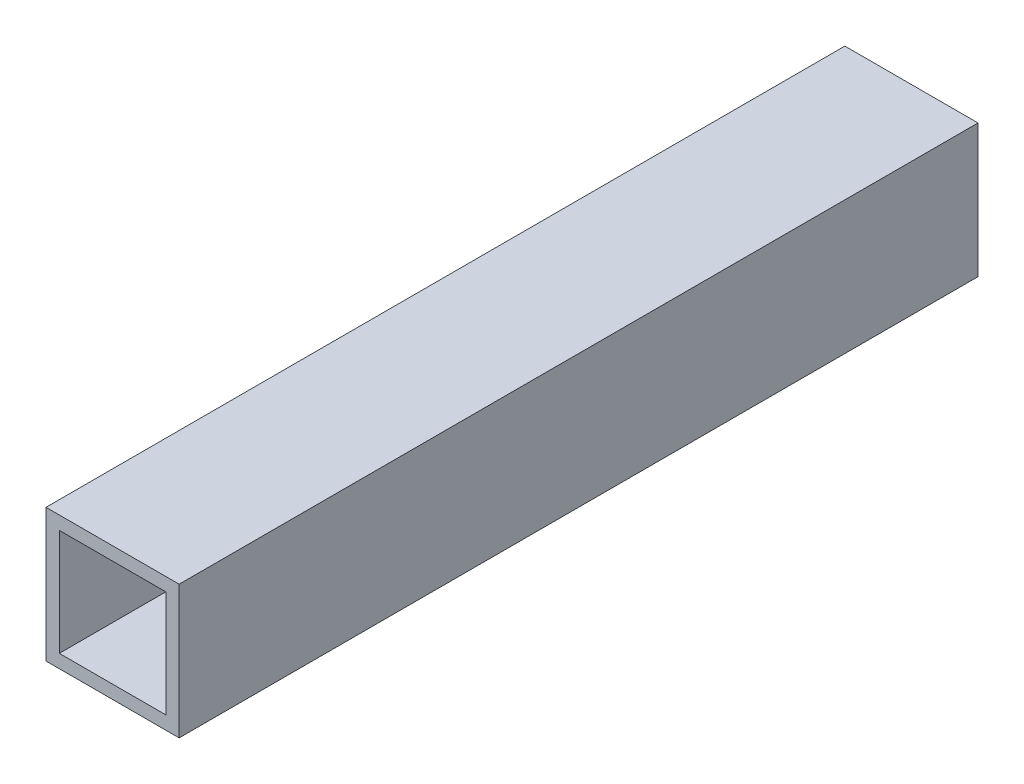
SolidWorks part; units mm, degrees
ref_plane "Plan de face" through (0, 0, 0) normal (0, 0, 1) x (1, 0, 0)
ref_plane "Plan de dessus" through (0, 0, 0) normal (0, 1, 0) x (1, 0, 0)
ref_plane "Plan de droite" through (0, 0, 0) normal (1, 0, 0) x (0, 0, -1)
sketch "Esquisse1" plane through (0, 0, 0) normal (0, 0, 1) x (1, 0, 0)
  line L0 (-5, 45) -> (-45, 45)
  line L1 (0, 0) -> (-50, 0)
  line L2 (0, 0) -> (0, 50)
  line L3 (0, 50) -> (-50, 50)
  line L4 (-50, 0) -> (-50, 50)
  line L5 (-45, 5) -> (-45, 45)
  line L6 (-5, 5) -> (-45, 5)
  line L7 (-5, 5) -> (-5, 45)
  dimension "D1" = 50
  dimension "D2" = 50
  dimension "D3" = 5
extrude "Boss.-Extru.1" add sketch "Esquisse1" along normal blind 300
